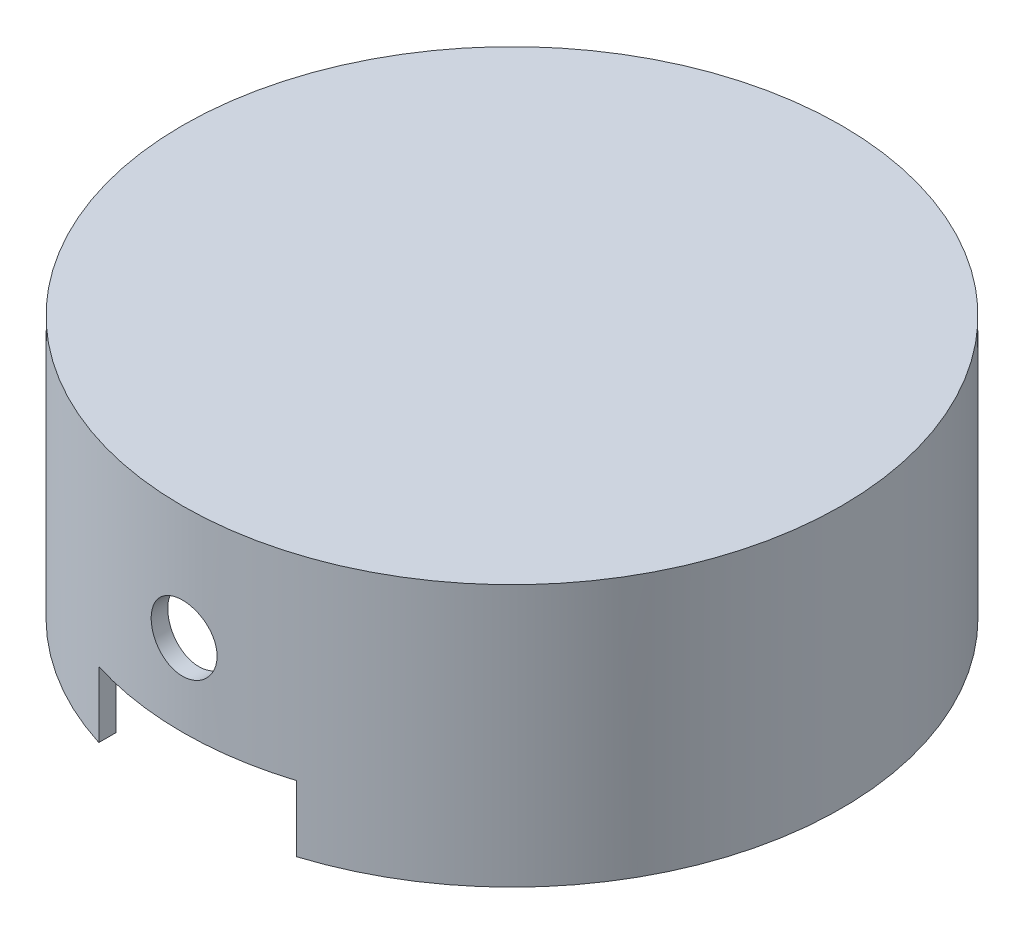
SolidWorks part; units mm, degrees
ref_plane "Front XY" through (0, 0, 0) normal (0, 0, 1) x (1, 0, 0)
ref_plane "Top XZ" through (0, 0, 0) normal (0, 1, 0) x (1, 0, 0)
ref_plane "Right YZ" through (0, 0, 0) normal (1, 0, 0) x (0, 0, -1)
sketch "Sketch1" plane through (0, 0, 0) normal (0, 1, 0) x (1, 0, 0)
  circle A0 centre (0, 0) radius 63.5
  arc A1 (0, 63.5) -> (0, -63.5) centre (0, 0) ccw construction
extrude "Extrude1" add sketch "Sketch1" against normal blind 50.4825
shell "Shell1" thickness 3.175
sketch "Sketch2" plane through (0, 0, 0) normal (0, 0, 1) x (1, 0, 0)
  line L0 (-63.5, -50.4825) -> (63.5, -50.4825) construction
  line L1 (-19.05, -37.7825) -> (19.05, -37.7825)
  line L2 (-19.05, -37.7825) -> (-19.05, -50.4825)
  line L3 (-19.05, -50.4825) -> (19.05, -50.4825)
  line L4 (19.05, -37.7825) -> (19.05, -50.4825)
  line L5 (-19.05, -37.7825) -> (19.05, -50.4825) construction
  line L6 (-19.05, -50.4825) -> (19.05, -37.7825) construction
  line L7 (0, -44.1325) -> (0, 0) construction
  circle A0 centre (0, -22.0662) radius 6.35
  point P0 (0, -44.1325)
  dimension "D3" = 12.7
  dimension "D1" = 12.7
  dimension "D2" = 38.1
extrude "Extrude2" cut sketch "Sketch2" against normal through all and the other way through all
